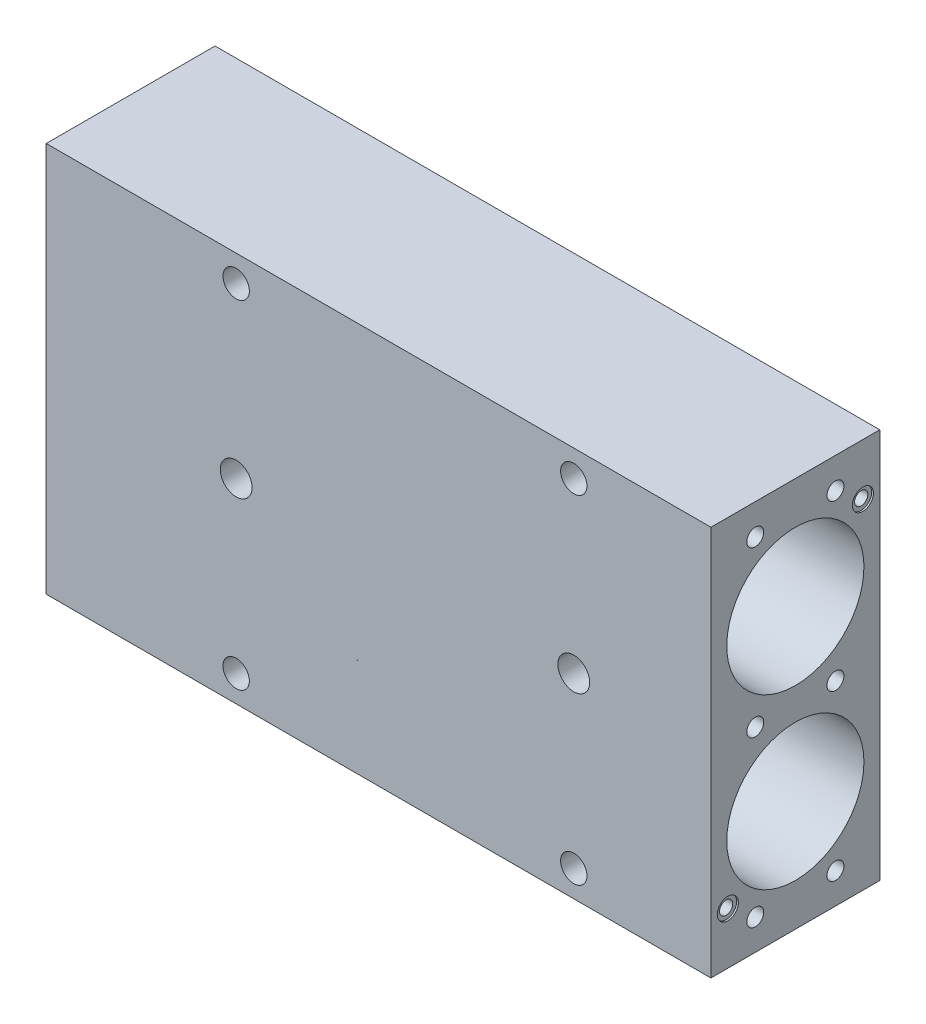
SolidWorks part; units mm, degrees
ref_plane "Front/Back" through (0, 0, 0) normal (0, 0, 1) x (1, 0, 0)
ref_plane "Top/Bottom" through (0, 0, 0) normal (0, 1, 0) x (1, 0, 0)
ref_plane "Right/Left" through (0, 0, 0) normal (1, 0, 0) x (0, 0, -1)
sketch "Sketch1" plane through (0, 0, 0) normal (0, 0, 1) x (1, 0, 0)
  line L0 (0, 0) -> (23.1406, 0) construction
  line L1 (-107.95, 58.7375) -> (92.075, 58.7375)
  line L2 (-107.95, 58.7375) -> (-107.95, -58.7375)
  line L3 (-107.95, -58.7375) -> (92.075, -58.7375)
  line L4 (92.075, 58.7375) -> (92.075, -58.7375)
  line L5 (0, 0) -> (0, 29.3721) construction
  dimension "D1" = 200.025
  dimension "D2" = 117.475
  dimension "D3" = 107.95
extrude "Extrude1" add sketch "Sketch1" along normal mid plane 50.8
sketch "Sketch2" plane through (0, 0, -25.4) normal (0, 0, -1) x (-1, 0, 0)
  circle A0 centre (0, 0) radius 27.5273
  dimension "D1" = 55.0545
extrude "Cut-Extrude1" cut sketch "Sketch2" against normal blind 3.9116
sketch "Sketch3" plane through (0, 0, -25.4) normal (0, 0, -1) x (-1, 0, 0)
  circle A0 centre (0, 0) radius 21.59
  dimension "D1" = 43.18
extrude "Cut-Extrude2" cut sketch "Sketch3" against normal blind 44.45
sketch "Sketch4" plane through (0, 0, -25.4) normal (0, 0, -1) x (-1, 0, 0)
  circle A0 centre (0, 0) radius 12.7
  dimension "D1" = 25.4
extrude "Cut-Extrude3" cut sketch "Sketch4" against normal blind 50.038
sketch "Sketch5" plane through (0, 0, -25.4) normal (0, 0, -1) x (-1, 0, 0)
  circle A0 centre (0, 0) radius 16.0274
  dimension "D1" = 32.0548
extrude "Cut-Extrude4" cut sketch "Sketch5" against normal blind 49.53
sketch "Sketch9" plane through (-107.95, 0, 0) normal (-1, 0, 0) x (0, 0, 1)
  line L0 (0, 0) -> (0, 16.8287) construction
  line L1 (0, 0) -> (13.0212, 0) construction
  circle A0 centre (0, 25.4) radius 20.6375
  circle A1 centre (0, -25.4) radius 20.6375
  dimension "D1" = 41.275
  dimension "D2" = 50.8
extrude "Cut-Extrude6" cut sketch "Sketch9" against normal through all
hole_wizard "3/8-16 Tapped Hole1" positions "Sketch22" profile "Sketch21" tap size "3/8-16" standard "Ansi Inch"
sketch "Sketch22" plane through (0, 0, 25.4) normal (0, 0, 1) x (1, 0, 0)
  line L3 (0, 0) -> (103.6592, 0) construction
  line L4 (0, 0) -> (0, -72.5044) construction
  point P1 (-50.8, 50.8)
  point P2 (-50.8, -50.8)
  point P4 (50.8, -50.8)
  point P6 (50.8, 50.8)
  dimension "D1" = 101.6
  dimension "D2" = 101.6
sketch "Sketch21" plane through (-50.8, 50.8, 25.4) normal (1, 0, 0) x (0, -1, 0)
  line L0 (0, 0) -> (0, 21.4347)
  line L1 (0, 21.4347) -> (3.9687, 19.05)
  line L2 (3.9687, 19.05) -> (3.9687, 0)
  line L5 (3.9687, 0) -> (0, 0)
  line L10 (0, 21.4347) -> (-3.9687, 19.05) construction
  line L11 (0, -6.35) -> (0, 107.95) construction
  dimension "Tap Drill Dia." = 7.9375
  dimension "Tap Drill Depth" = 19.05
  dimension "Drill Angle" = 118
sketch "Sketch10" plane through (0, 0, 25.4) normal (0, 0, 1) x (1, 0, 0)
  line L0 (0, 0) -> (20.4629, 0) construction
  line L1 (-50.8, -50.8) -> (-50.8, -70.8338) construction
  circle A0 centre (-50.8, 0) radius 4.7879
  dimension "D1" = 9.5758
extrude "Cut-Extrude7" cut sketch "Sketch10" against normal blind 12.7
hole_wizard "#10-32 Tapped Hole1" positions "Sketch12" profile "Sketch11" tap size "#10-32" standard "Ansi Inch"
sketch "Sketch12" plane through (30.7404, 37.1438, -25.4) normal (0, 0, 1) x (1, 0, 0)
  line L0 (-30.7404, -37.1438) -> (-30.7404, 27.37) construction
  line L1 (-30.7404, -37.1438) -> (21.5329, -37.1438) construction
  point P0 (-39.6304, 13.6562)
  point P1 (-21.8504, 13.6562)
  point P2 (20.0596, -37.1438)
  point P3 (-21.8504, -87.9438)
  point P4 (-39.6304, -87.9438)
  point P5 (-67.6466, -37.1438)
  point P10 (-81.5404, -37.1438)
  dimension "D1" = 50.8
  dimension "D2" = 50.8
  dimension "D3" = 8.89
  dimension "D4" = 36.9062
sketch "Sketch11" plane through (-8.89, 50.8, -25.4) normal (1, 0, 0) x (0, 1, 0)
  line L0 (0, 0) -> (0, 22.6407)
  line L1 (0, 22.6407) -> (2.0193, 21.4274)
  line L2 (2.0193, 21.4274) -> (2.0193, 0)
  line L5 (2.0193, 0) -> (0, 0)
  line L10 (0, 22.6407) -> (-2.0193, 21.4274) construction
  line L11 (0, -6.35) -> (0, 107.95) construction
  dimension "Tap Drill Dia." = 4.0386
  dimension "Tap Drill Depth" = 21.4274
  dimension "Drill Angle" = 118
sketch "Sketch13" plane through (0, 0, -25.4) normal (0, 0, 1) x (1, 0, 0)
  line L0 (0, 0) -> (14.5473, 0) construction
  line L1 (0, 0) -> (0, 21.3538) construction
  circle A0 centre (36.9062, 0) radius 3.9751
  dimension "D1" = 7.9502
  dimension "D2" = 36.9062
extrude "Cut-Extrude8" cut sketch "Sketch13" along normal blind 19.05
hole_wizard "#8-32 Tapped Hole1" positions "Sketch15" profile "Sketch14" tap size "#8-32" standard "Ansi Inch"
sketch "Sketch15" plane through (39.3972, -44.0872, -25.4) normal (0, 0, 1) x (1, 0, 0)
  line L0 (-2.491, 44.0872) -> (-2.491, 29.3249) construction
  line L1 (-39.3972, 44.0872) -> (22.1198, 44.0872) construction
  point P0 (-2.491, 37.7372)
  point P1 (-2.491, 50.4372)
  dimension "D1" = 12.7
sketch "Sketch14" plane through (36.9062, -6.35, -25.4) normal (1, 0, 0) x (0, 1, 0)
  line L0 (0, 0) -> (0, 12.9402)
  line L1 (0, 12.9402) -> (1.7272, 11.9024)
  line L2 (1.7272, 11.9024) -> (1.7272, 0)
  line L5 (1.7272, 0) -> (0, 0)
  line L10 (0, 12.9402) -> (-1.7272, 11.9024) construction
  line L11 (0, -6.35) -> (0, 107.95) construction
  dimension "Tap Drill Dia." = 3.4544
  dimension "Tap Drill Depth" = 11.9024
  dimension "Drill Angle" = 118
hole_wizard "1/4-20 Tapped Hole1" positions "Sketch17" profile "Sketch16" tap size "1/4-20" standard "Ansi Inch"
sketch "Sketch17" plane through (92.075, 0, 0) normal (1, 0, 0) x (0, 0, -1)
  line L0 (0, 0) -> (43.3681, 0) construction
  line L1 (0, 0) -> (0, 21.264) construction
  point P0 (-12.065, 49.53)
  point P1 (12.065, 49.53)
  point P2 (-12.065, 0)
  point P3 (12.065, 0)
  point P4 (12.065, -49.53)
  point P5 (-12.065, -49.53)
  dimension "D1" = 49.53
  dimension "D2" = 12.065
sketch "Sketch16" plane through (92.075, 49.53, 12.065) normal (0, 1, 0) x (0, 0, -1)
  line L0 (0, 0) -> (0, 18.0438)
  line L1 (0, 18.0438) -> (2.5527, 16.51)
  line L2 (2.5527, 16.51) -> (2.5527, 0)
  line L5 (2.5527, 0) -> (0, 0)
  line L10 (0, 18.0438) -> (-2.5527, 16.51) construction
  line L11 (0, -6.35) -> (0, 107.95) construction
  dimension "Tap Drill Dia." = 5.1054
  dimension "Tap Drill Depth" = 16.51
  dimension "Drill Angle" = 118
sketch "Sketch18" plane through (92.075, 0, 0) normal (1, 0, 0) x (0, 0, -1)
  line L0 (0, 0) -> (0, 21.8675) construction
  line L1 (0, 0) -> (42.4629, 0) construction
  line L2 (0, -25.4) -> (-51.6691, -25.4) construction
  line L3 (0, 25.4) -> (48.1953, 25.4) construction
  circle A0 centre (-20.32, -43.18) radius 1.9939
  circle A2 centre (20.32, 43.18) radius 1.9939
  dimension "D1" = 3.9878
  dimension "D5" = 20.32
  dimension "D2" = 20.32
  dimension "D3" = 17.78
  dimension "D4" = 17.78
extrude "Cut-Extrude9" cut sketch "Sketch18" against normal blind 185.42
sketch "Sketch19" plane through (92.075, 0, 0) normal (1, 0, 0) x (0, 0, -1)
  circle A0 centre (-20.32, -43.18) radius 3.175
  circle A1 centre (20.32, 43.18) radius 3.175
  dimension "D1" = 6.35
extrude "Cut-Extrude10" cut sketch "Sketch19" against normal blind 0.508
sketch "Sketch20" plane through (-107.95, 0, 0) normal (-1, 0, 0) x (0, 0, 1)
  circle A0 centre (0, 25.4) radius 21.4312
  circle A1 centre (0, -25.4) radius 21.4312
  dimension "D1" = 42.8625
extrude "Cut-Extrude11" cut sketch "Sketch20" against normal blind 15.24
mirror "Mirror2" about plane through (0, 0, 0) normal (1, 0, 0) of "Cut-Extrude7"
